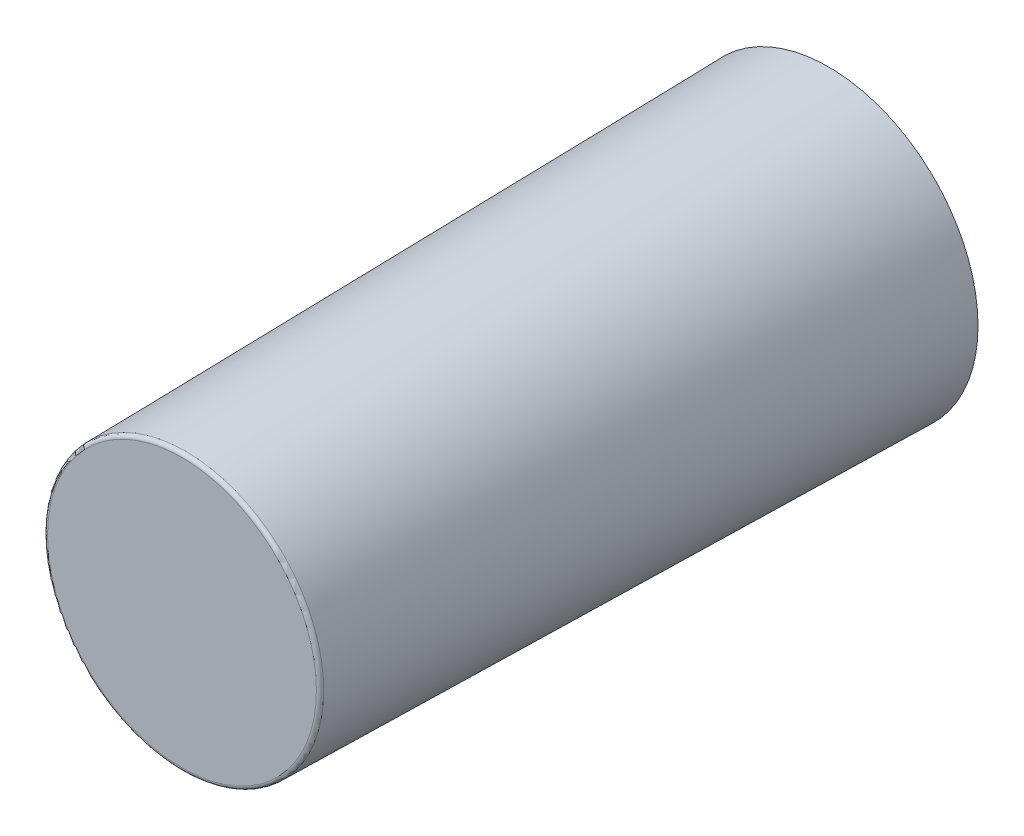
SolidWorks part; units mm, degrees
ref_plane "Front Plane" through (0, 0, 0) normal (0, 0, 1) x (1, 0, 0)
ref_plane "Top Plane" through (0, 0, 0) normal (0, 1, 0) x (1, 0, 0)
ref_plane "Right Plane" through (0, 0, 0) normal (1, 0, 0) x (0, 0, -1)
sketch "Sketch1" plane through (0, 0, 0) normal (0, 0, 1) x (1, 0, 0)
  circle A0 centre (0, 0) radius 7.8613
  dimension "D1" = 15.7226
extrude "Boss-Extrude1" add sketch "Sketch1" along normal blind 27.4574
sketch "Sketch2" plane through (0, 0, 27.4574) normal (0, 0, 1) x (1, 0, 0)
  circle A0 centre (0, 0) radius 20.193
  dimension "D1" = 40.386
extrude "Boss-Extrude2" add sketch "Sketch2" along normal blind 87.4395
draft "Draft4" type of draft neutral plane draft angle 1 faces to draft 1 parameters "D1"=1
fillet "Fillet1" radius 0.5 1 edges at (18.6667, 0, 114.8969)
sketch "Sketch3" plane through (0, 0, 0) normal (0, 0, -1) x (-1, 0, 0)
  circle A1 centre (0, 0) radius 7.8613
  circle A2 centre (0, 0) radius 7.8613
  dimension "D1" = 0
extrude "Cut-Extrude1" cut sketch "Sketch3" against normal up to surface (27.4574 mm away)
